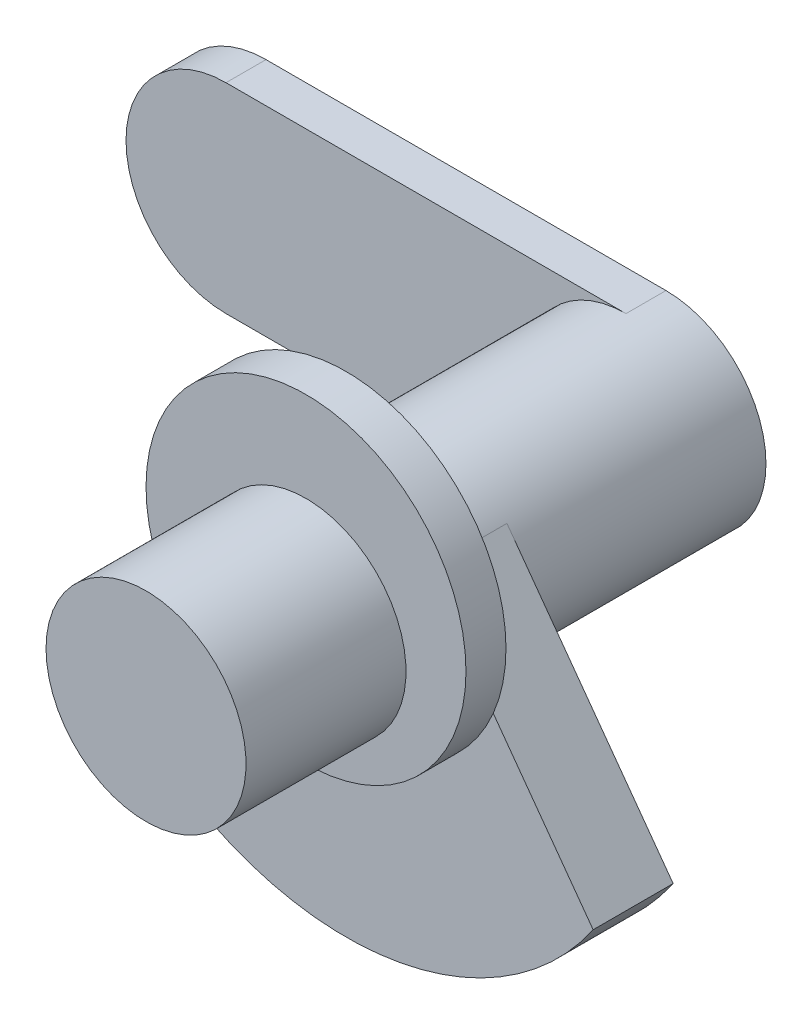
SolidWorks part; units mm, degrees
ref_plane "Front Plane" through (0, 0, 0) normal (0, 0, 1) x (1, 0, 0)
ref_plane "Top Plane" through (0, 0, 0) normal (0, 1, 0) x (1, 0, 0)
ref_plane "Right Plane" through (0, 0, 0) normal (1, 0, 0) x (0, 0, -1)
sketch "Sketch1" plane through (0, 0, 0) normal (0, 0, 1) x (1, 0, 0)
  circle A0 centre (0, 0) radius 63.5
  dimension "D1" = 127
extrude "Boss-Extrude1" add sketch "Sketch1" along normal mid plane 304.8
ref_plane "Plane1" through (0, 0, 25.4) normal (0, 0, 1) x (1, 0, 0)
sketch "Sketch2" plane through (0, 0, 25.4) normal (0, 0, 1) x (1, 0, 0)
  circle A0 centre (0, 19.05) radius 101.6
  dimension "D1" = 203.2
  dimension "D2" = 19.05
extrude "Boss-Extrude2" add sketch "Sketch2" along normal blind 25.4
sketch "Sketch3" plane through (0, 0, 25.4) normal (0, 0, 1) x (1, 0, 0)
  line L0 (51.3726, 37.3244) -> (156.9418, -107.9792)
  line L1 (-51.3726, 37.3244) -> (-156.9418, -107.9792)
  line L2 (0, 0) -> (0, -359.7719) construction
  circle A0 centre (0, 0) radius 63.5 construction
  circle A1 centre (0, 0) radius 63.5
  circle A2 centre (0, 0) radius 190.5 construction
  circle A3 centre (0, 0) radius 63.5 construction
  arc A4 (156.9418, -107.9792) -> (-156.9418, -107.9792) centre (0, 0) cw
  dimension "D1" = 381
  dimension "D2" = 36
extrude "Boss-Extrude3" add sketch "Sketch3" against normal blind 50.8 contours A4 L0 A1 L1
sketch "Sketch4" plane through (0, 0, -152.4) normal (0, 0, -1) x (-1, 0, 0)
  line L0 (0, 63.5) -> (254, 63.5)
  line L1 (0, -63.5) -> (254, -63.5)
  circle A0 centre (0, 0) radius 63.5 construction
  arc A1 (0, 63.5) -> (0, -63.5) centre (0, 0) ccw
  arc A2 (254, 63.5) -> (254, -63.5) centre (254, 0) cw
  dimension "D1" = 254
extrude "Boss-Extrude4" add sketch "Sketch4" along normal blind 25.4
